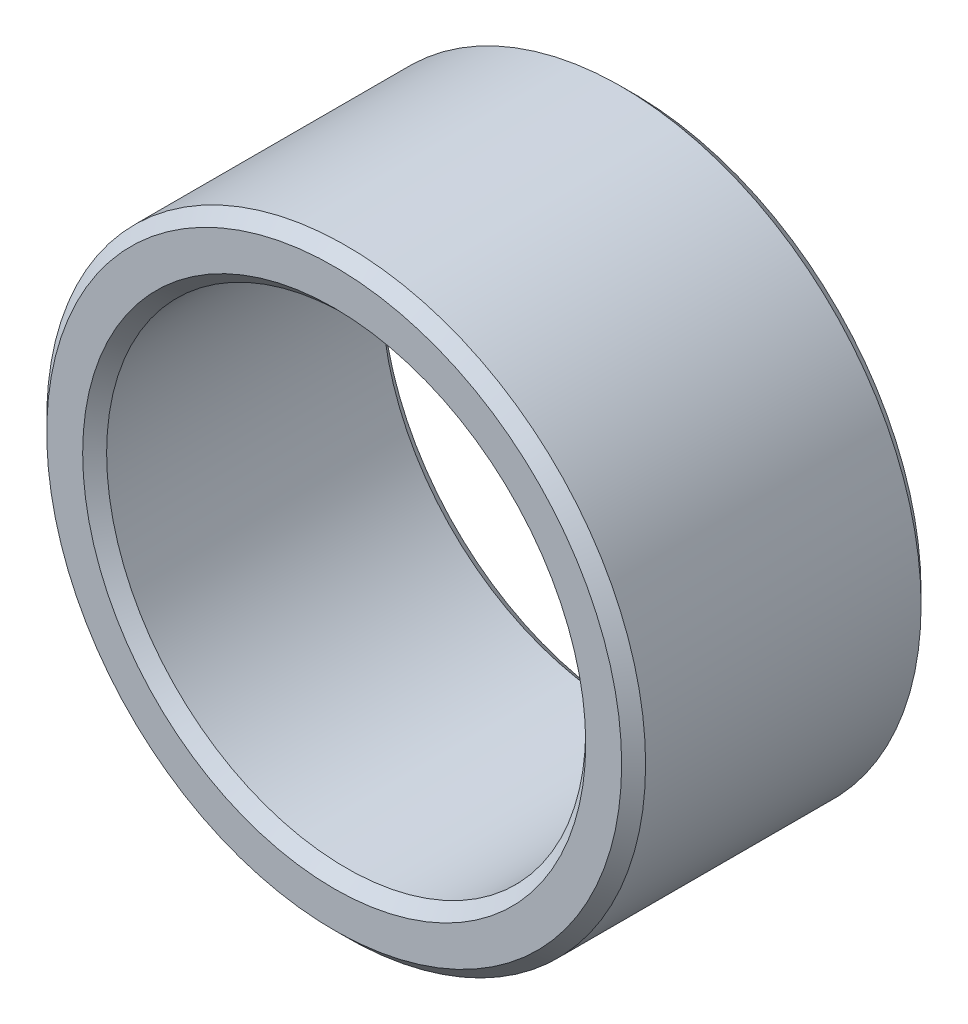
SolidWorks part; units mm, degrees
ref_plane "Plan de face" through (0, 0, 0) normal (0, 0, 1) x (1, 0, 0)
ref_plane "Plan de dessus" through (0, 0, 0) normal (0, 1, 0) x (1, 0, 0)
ref_plane "Plan de droite" through (0, 0, 0) normal (1, 0, 0) x (0, 0, -1)
sketch "Esquisse1" plane through (0, 0, 0) normal (0, 0, 1) x (1, 0, 0)
  circle A0 centre (0, 0) radius 20
  circle A1 centre (0, 0) radius 25
extrude "Extrusion1" add sketch "Esquisse1" along normal blind 25
chamfer "Chanfrein1" distance 1 angle 45 4 edges at (25, 0, 0) (25, 0, 25) (20, 0, 0) (20, 0, 25)
